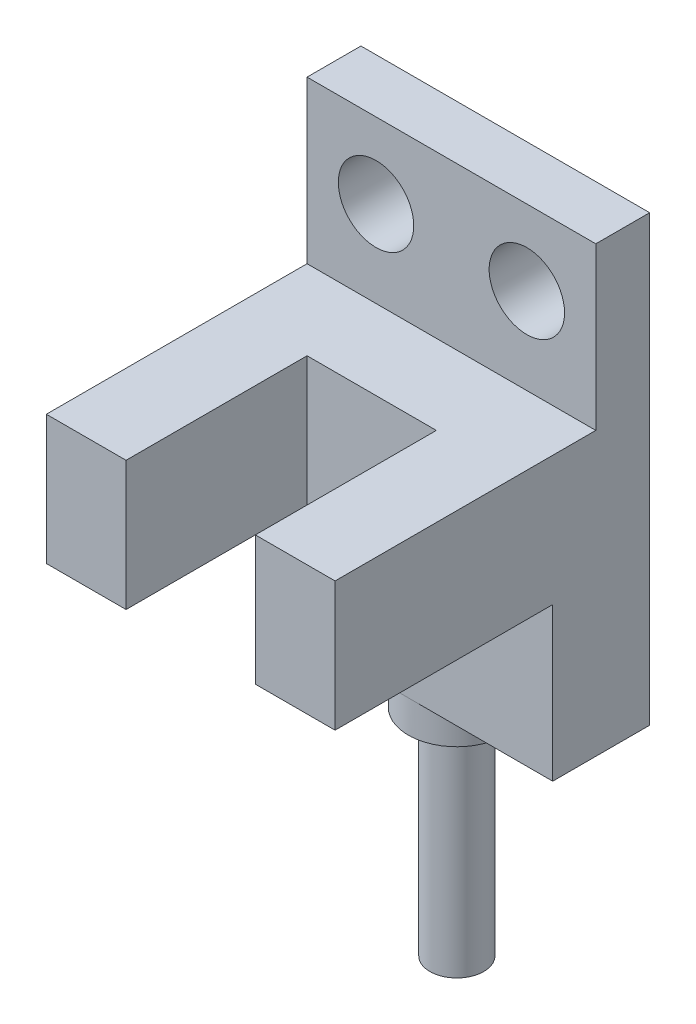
SolidWorks part; units mm, degrees
ref_plane "前视基准面" through (0, 0, 0) normal (0, 0, 1) x (1, 0, 0)
ref_plane "上视基准面" through (0, 0, 0) normal (0, 1, 0) x (1, 0, 0)
ref_plane "右视基准面" through (0, 0, 0) normal (1, 0, 0) x (0, 0, -1)
sketch "草图1" plane through (0, 0, 0) normal (0, 0, 1) x (1, 0, 0)
  line L0 (0, 0) -> (0, 20.6)
  line L1 (0, 20.6) -> (13.4, 20.6)
  line L2 (13.4, 20.6) -> (13.4, 0)
  line L3 (13.4, 0) -> (0, 0)
extrude "凸台-拉伸1" add sketch "草图1" along normal blind 4.5
sketch "草图2" plane through (0, 0, 4.5) normal (0, 0, 1) x (1, 0, 0)
  line L0 (13.4, 20.6) -> (13.4, 13.1)
  line L1 (13.4, 0) -> (13.4, 20.6) construction
  line L2 (13.4, 13.1) -> (0, 13.1)
  line L3 (0, 20.6) -> (0, 0) construction
  line L4 (0, 13.1) -> (0, 20.6)
  line L5 (0, 20.6) -> (13.4, 20.6)
extrude "切除-拉伸2" cut sketch "草图2" against normal blind 2 contours L5 L0 L2 L4
sketch "草图5" plane through (0, 0, 2.5) normal (0, 0, 1) x (1, 0, 0)
  circle A0 centre (3.2, 17.1) radius 1.75
  circle A1 centre (10.2, 17.1) radius 1.75
extrude "切除-拉伸3" cut sketch "草图5" against normal blind 2.5
sketch "草图6" plane through (0, 0, 4.5) normal (0, 0, 1) x (1, 0, 0)
  line L0 (0, 13.1) -> (0, 7.1)
  line L1 (0, 13.1) -> (0, 0) construction
  line L2 (0, 13.1) -> (3.7, 13.1)
  line L3 (13.4, 13.1) -> (0, 13.1) construction
  line L4 (3.7, 13.1) -> (3.7, 7.1)
  line L5 (3.7, 7.1) -> (0, 7.1)
extrude "凸台-拉伸2" add sketch "草图6" along normal blind 10.1
sketch "草图7" plane through (0, 0, 4.5) normal (0, 0, 1) x (1, 0, 0)
  line L0 (13.4, 13.1) -> (13.4, 7.1)
  line L1 (13.4, 0) -> (13.4, 13.1) construction
  line L2 (13.4, 13.1) -> (9.7, 13.1)
  line L3 (13.4, 13.1) -> (0, 13.1) construction
  line L5 (9.7, 13.1) -> (9.7, 7.1)
  line L6 (9.7, 7.1) -> (13.4, 7.1)
extrude "凸台-拉伸3" add sketch "草图7" along normal blind 10.1
sketch "草图8" plane through (0, 0, 4.5) normal (0, 0, 1) x (1, 0, 0)
  line L0 (3.7, 13.1) -> (9.7, 13.1)
  line L1 (9.7, 13.1) -> (9.7, 7.1)
  line L2 (9.7, 7.1) -> (3.7, 7.1)
  line L3 (3.7, 7.1) -> (3.7, 13.1)
extrude "凸台-拉伸4" add sketch "草图8" along normal blind 1.7
sketch "草图9" plane through (0, 0, 0) normal (0, -1, 0) x (1, 0, 0)
  circle A0 centre (6.7, 2.25) radius 2.25
extrude "凸台-拉伸7" add sketch "草图9" along normal blind 1.5 contours A0
sketch "草图13" plane through (0, -1.5, 0) normal (0, -1, 0) x (1, 0, 0)
  circle A0 centre (6.7, 2.25) radius 1.25
extrude "凸台-拉伸8" add sketch "草图13" along normal blind 10
